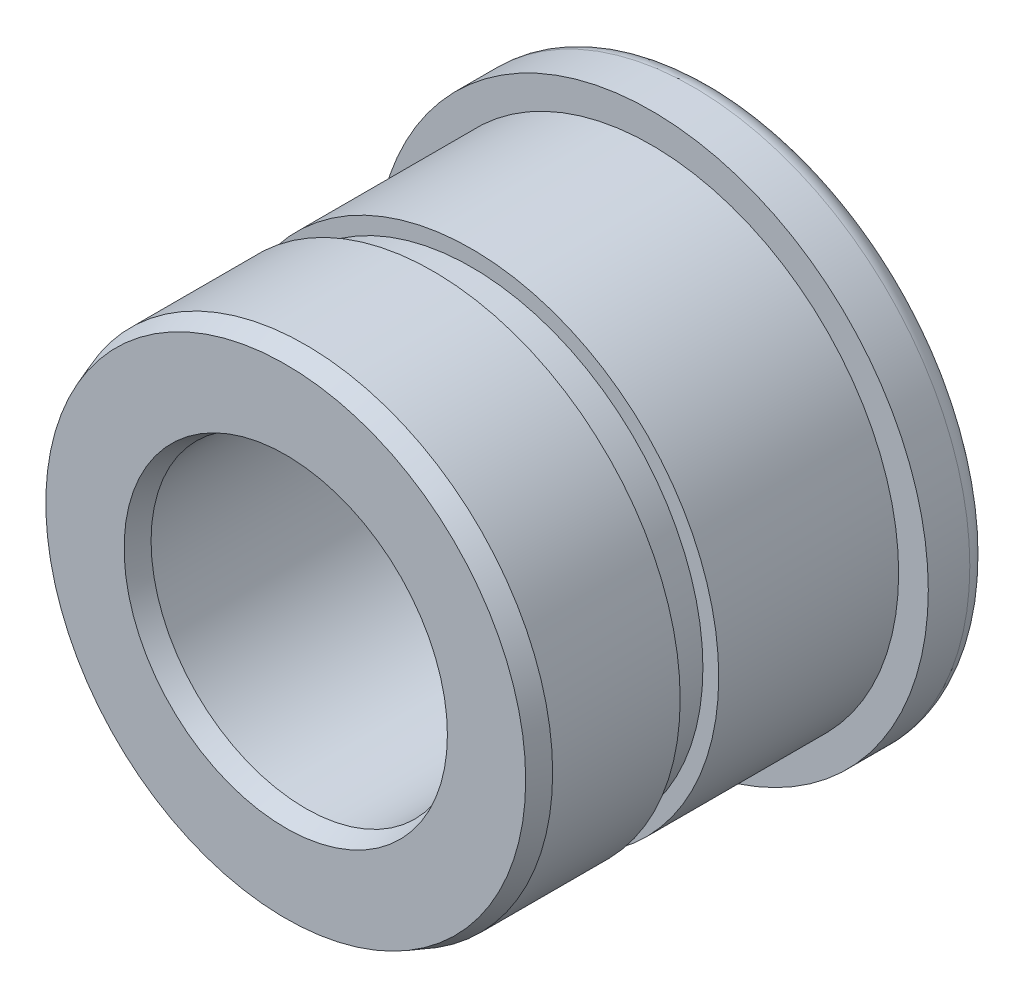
SolidWorks part; units mm, degrees
ref_plane "Front Plane" through (0, 0, 0) normal (0, 0, 1) x (1, 0, 0)
ref_plane "Top Plane" through (0, 0, 0) normal (0, 1, 0) x (1, 0, 0)
ref_plane "Right Plane" through (0, 0, 0) normal (1, 0, 0) x (0, 0, -1)
sketch "Sketch1" plane through (0, 0, 0) normal (0, 0, 1) x (1, 0, 0)
  circle A0 centre (0, 0) radius 7.112
extrude "Boss-Extrude1" add sketch "Sketch1" along normal blind 1.5748
sketch "Sketch2" plane through (0, 0, 1.5748) normal (0, 0, 1) x (1, 0, 0)
  circle A0 centre (0, 0) radius 6.35
extrude "Boss-Extrude2" add sketch "Sketch2" along normal blind 4.6228
sketch "Sketch5" plane through (0, 0, 6.1976) normal (0, 0, 1) x (1, 0, 0)
  circle A0 centre (0, 0) radius 5.9436
extrude "Boss-Extrude3" add sketch "Sketch5" along normal blind 0.9906
sketch "Sketch6" plane through (0, 0, 7.1882) normal (0, 0, 1) x (1, 0, 0)
  circle A0 centre (0, 0) radius 6.35
extrude "Boss-Extrude4" add sketch "Sketch6" along normal blind 3.7846
hole_wizard "5/16 (0.3125) Diameter Hole1" positions "Sketch3" profile "Sketch4" hole size "5/16" standard "ANSI Inch"
sketch "Sketch3" plane through (0, 0, 0) normal (0, 0, -1) x (-1, 0, 0)
  point P0 (0, 0)
sketch "Sketch4" plane through (0, 0, 0) normal (1, 0, 0) x (0, 1, 0)
  line L0 (0, 0) -> (0, 10.9728)
  line L1 (0, 10.9728) -> (3.9687, 10.9728)
  line L2 (3.9687, 10.9728) -> (3.9687, 0)
  line L5 (3.9687, 0) -> (0, 0)
  line L11 (0, -6.35) -> (0, 107.95) construction
  dimension "Thru Hole Dia." = 7.9375
  dimension "Thru Hole Depth" = 10.9728
fillet "Fillet1" radius 0.508 1 edges at (7.112, 0, 0)
chamfer "Chamfer1" distance 0.508 angle 20 1 edges at (-3.9687, 0, 0)
chamfer "Chamfer3" distance 0.508 angle 20 1 edges at (-3.9687, 0, 10.9728)
chamfer "Chamfer4" distance 0.508 angle 20 1 edges at (6.35, 0, 10.9728)
